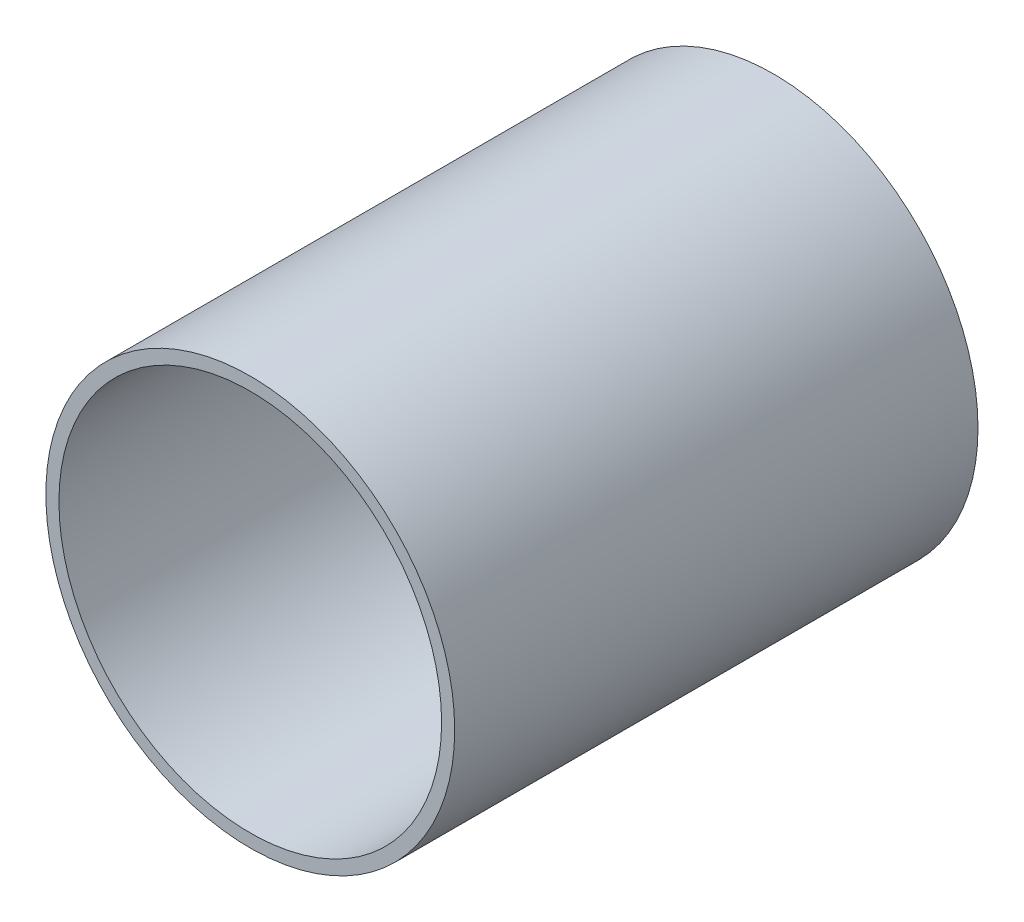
SolidWorks part; units mm, degrees
ref_plane "Plan de face" through (0, 0, 0) normal (0, 0, 1) x (1, 0, 0)
ref_plane "Plan de dessus" through (0, 0, 0) normal (0, 1, 0) x (1, 0, 0)
ref_plane "Plan de droite" through (0, 0, 0) normal (1, 0, 0) x (0, 0, -1)
sketch "Esquisse1" plane through (0, 0, 0) normal (0, 0, 1) x (1, 0, 0)
  circle A0 centre (0, 0) radius 62.5
  circle A1 centre (0, 0) radius 58.5
  dimension "D1" = 125
  dimension "D2" = 117
extrude "Boss.-Extru.1" add sketch "Esquisse1" along normal blind 160
